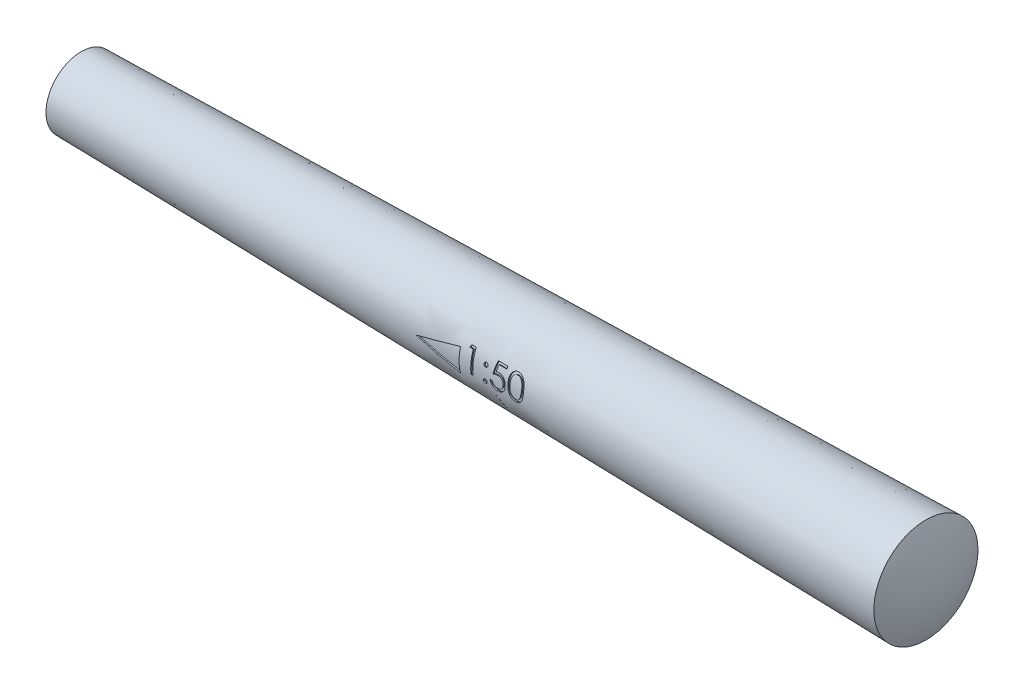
SolidWorks part; units mm, degrees
ref_plane "Front Plane" through (0, 0, 0) normal (0, 0, 1) x (1, 0, 0)
ref_plane "Top Plane" through (0, 0, 0) normal (0, 1, 0) x (1, 0, 0)
ref_plane "Right Plane" through (0, 0, 0) normal (1, 0, 0) x (0, 0, -1)
sketch "Sketch1" plane through (0, 0, 0) normal (1, 0, 0) x (0, 0, -1)
  circle A0 centre (0, 0) radius 1.5
  dimension "D1" = 3
extrude "Extrude1" add sketch "Sketch1" along normal mid plane 36
draft "Draft1" type of draft neutral plane draft angle 1.146 faces to draft 1 parameters "D1"=1.146
sketch "Sketch2" plane through (0, 0, 0) normal (0, 0, 1) x (1, 0, 0)
  line L0 (-18, 0) -> (-18, 1.5)
  line L1 (-18, 1.5) -> (-18, -1.5) construction
  line L2 (-18, 0) -> (-18.45, 0)
  line L3 (-18.45, 0) -> (-18.45, -1.86) construction
  line L4 (18, 0) -> (18, 2.22)
  line L5 (18, -2.22) -> (18, 2.22) construction
  line L6 (18, 0) -> (18.45, 0)
  line L7 (18.45, 0) -> (18.45, -1.86) construction
  line L8 (-18, -1.5) -> (18, -2.22) construction
  arc A0 (-18.45, 0) -> (-18, 1.5) centre (-15.725, 0) cw
  arc A1 (18.45, 0) -> (18, 2.22) centre (12.7489, 0) ccw
  point P14 (0, -1.86)
revolve "Revolve1" add sketch "Sketch2" angle 360 about L2
sketch "Sketch5" plane through (0, 0, 0) normal (0, 0, 1) x (1, 0, 0)
  line L0 (0, 1.86) -> (0, -1.86) construction
  line L1 (18, 2.22) -> (-18, 1.5) construction
  line L2 (-18, -1.5) -> (18, -2.22) construction
ref_plane "Plane2" through (0, 0, 0) normal (-0.02, 0, 0.9998) x (0.9998, 0, 0.02)
sketch "Sketch6" plane through (0, 0, 0) normal (-0.02, 0, 0.9998) x (0.9998, 0, 0.02)
  line L0 (0, 0) -> (0, 0.5)
  line L1 (0, 1.86) -> (0, -1.86) construction
  line L2 (0, 0.5) -> (-1.866, 0)
  line L3 (-1.866, 0) -> (0, -0.5)
  line L4 (0, -0.5) -> (0, 0)
  line L5 (0, -0.25) -> (3, -0.25) construction
  text T0 "1:50" font "Century Gothic" height 1
  dimension "D1" = 1
  dimension "D2" = 30
  dimension "D3" = 3
wrap "Wrap2" sketch "Sketch6" wrap type deboss source sketch "Sketch6" thickness 0.05 parameters "D1"=0.05
equation "\"D2@Sketch2\" = \"D1@Sketch2\""
